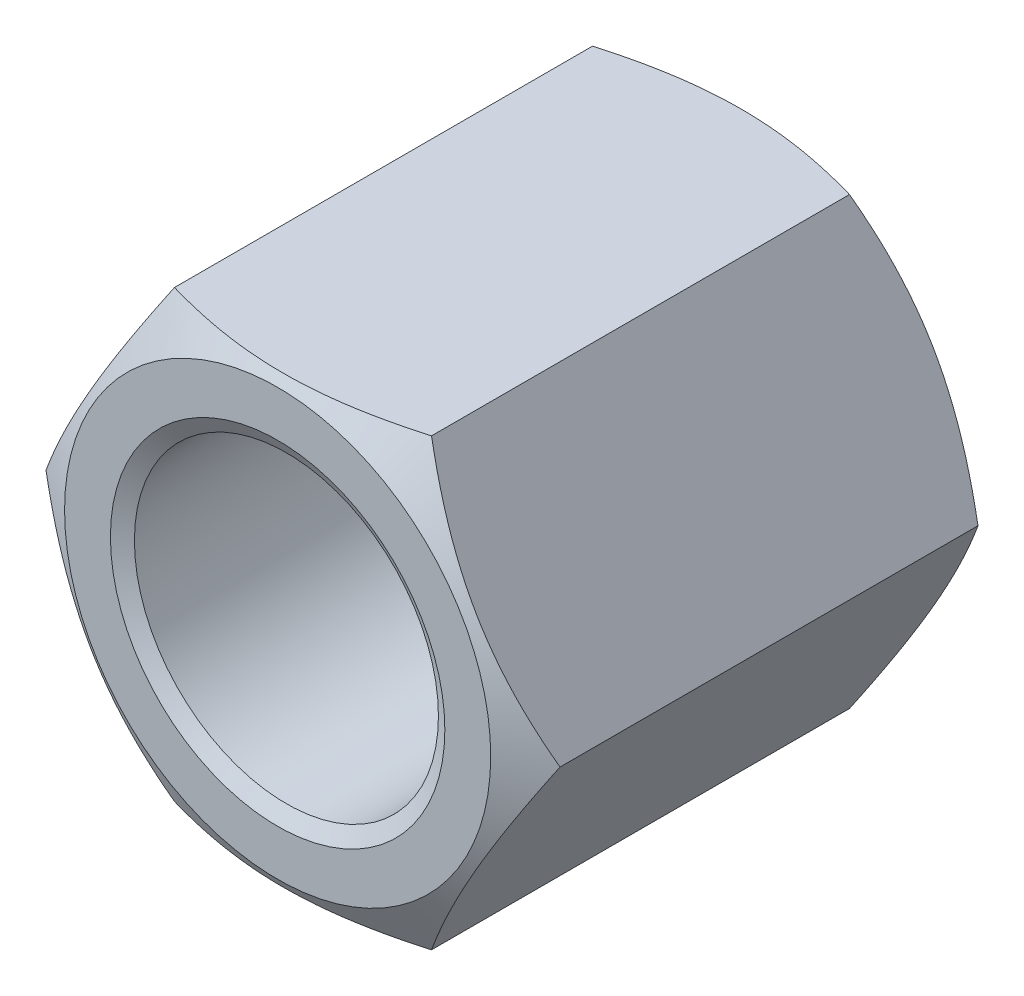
SolidWorks part; units mm, degrees
ref_plane "Front" through (0, 0, 0) normal (0, 0, 1) x (1, 0, 0)
ref_plane "Top" through (0, 0, 0) normal (0, 1, 0) x (1, 0, 0)
ref_plane "Right" through (0, 0, 0) normal (1, 0, 0) x (0, 0, -1)
sketch "Sketch1" plane through (0, 0, 0) normal (0, 0, 1) x (1, 0, 0)
  line L1 (5.072, -8.785) -> (10.144, 0)
  line L2 (10.144, 0) -> (5.072, 8.785)
  line L3 (5.072, 8.785) -> (-5.072, 8.785)
  line L4 (-5.072, 8.785) -> (-10.144, 0)
  line L5 (-10.144, 0) -> (-5.072, -8.785)
  line L6 (-5.072, -8.785) -> (5.072, -8.785)
  circle A0 centre (0, 0) radius 8.785 construction
  circle A1 centre (0, 0) radius 6
  dimension "D" = 12
  dimension "s" = 17.57
  dimension "e" = 20.2881
extrude "BaseNut" add sketch "Sketch1" against normal blind 18.5
sketch "Sketch2" plane through (0, 0, 0) normal (0, 1, 0) x (1, 0, 0)
  line L0 (-10.144, 18.5) -> (-8.41, 18.5)
  line L2 (-8.41, 18.5) -> (-10.144, 17.4988)
  line L3 (-10.144, 17.4988) -> (-10.144, 18.5)
  line L4 (0, 3.3759) -> (0, -9.8171) construction
  line L6 (-9.7712, 9.25) -> (9.8853, 9.25) construction
  line L7 (-10.144, 1.0012) -> (-10.144, 0)
  line L8 (-8.41, 0) -> (-10.144, 1.0012)
  line L9 (-10.144, 0) -> (-8.41, 0)
  dimension "D1" = 30
  dimension "dw" = 16.82
  dimension "D2" = 9.25
revolve "Double-Chamfer" cut sketch "Sketch2" angle 360 about L4
chamfer "EndChamfer" distance 0.6 angle 30 2 edges at (6, 0, 0) (6, 0, -18.5)
sketch "Sketch3" plane through (0, 0, 0) normal (0, 1, 0) x (1, 0, 0)
  line L0 (0, 28.565) -> (0, -12.1255) construction
  line L1 (5.5, 18.15) -> (6, 18.15)
  line L2 (6, 18.15) -> (6.433, 17.9)
  line L3 (6.433, 17.9) -> (6, 17.65)
  line L4 (6, 17.65) -> (5.5, 17.65)
  line L5 (5.5, 17.65) -> (5.5, 18.15)
  line L6 (6, 17.9) -> (-6, 17.9) construction
  dimension "D1" = 0.5
  dimension "D2" = 12
revolve "Cut-Revolve10" [suppressed] cut sketch "Sketch3" angle 360 about L0
pattern_linear "LPattern10" [suppressed] count 30 spacing 0.6 along (0, 0, 1)
equation "\"dw@Sketch2\" = \"s@Sketch1\" - 0.75"
equation "\"D2@Sketch2\" = \"m@BaseNut\" / 2"
equation "\"D1@EndChamfer\" = \"D@Sketch1\" / 20"
equation "\"D1@Sketch3\" = (  \"D2@ThreadCosmetic1\" - \"D@Sketch1\" )  / 2"
equation "\"D2@Sketch3\" = \"D@Sketch1\""
equation "\"D3@LPattern10\" = \"D1@Sketch3\" * 1.2"
equation "\"D1@LPattern10\" = (  \"m@BaseNut\"  - \"D1@EndChamfer\")  / \"D3@LPattern10\" "
